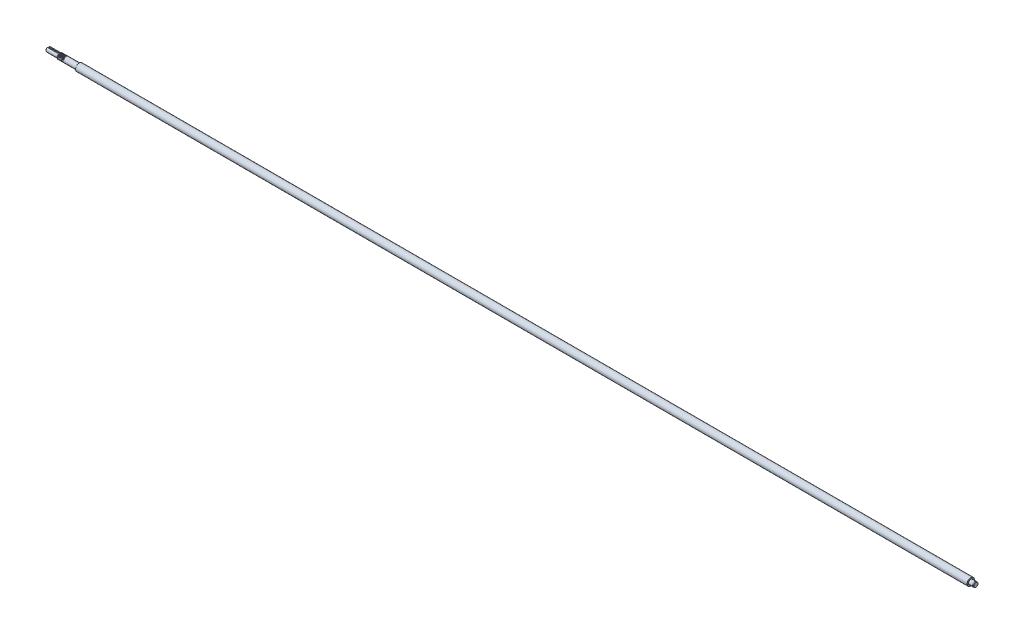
SolidWorks part; units mm, degrees
ref_plane "Front Plane" through (0, 0, 0) normal (0, 0, 1) x (1, 0, 0)
ref_plane "Top Plane" through (0, 0, 0) normal (0, 1, 0) x (1, 0, 0)
ref_plane "Right Plane" through (0, 0, 0) normal (1, 0, 0) x (0, 0, -1)
sketch "Sketch1" plane through (0, 0, 0) normal (0, 0, 1) x (1, 0, 0)
  line L0 (-23.245, 0) -> (-23.245, 5)
  line L1 (-23.245, 5) -> (1.755, 5)
  line L2 (1.755, 5) -> (1.755, 6)
  line L3 (1.755, 6) -> (43.755, 6)
  line L4 (43.755, 6) -> (43.755, 7.9)
  line L5 (43.755, 7.9) -> (1965.755, 7.9)
  line L6 (1965.755, 7.9) -> (1965.755, 5)
  line L7 (1965.755, 5) -> (1973.755, 5)
  line L8 (1973.755, 5) -> (1973.755, 4.8)
  line L9 (1973.755, 4.8) -> (1974.905, 4.8)
  line L10 (1974.905, 4.8) -> (1974.905, 5)
  line L11 (1974.905, 5) -> (1976.755, 5)
  line L12 (1976.755, 5) -> (1976.755, 0)
  line L13 (1976.755, 0) -> (-23.245, 0)
  point P3 (43.755, 6.95)
  dimension "D1" = 5
  dimension "D2" = 25
  dimension "D3" = 6
  dimension "D4" = 67
  dimension "D5" = 1922
  dimension "D6" = 11
  dimension "D7" = 5
  dimension "D8" = 4.8
  dimension "D9" = 1.15
  dimension "D10" = 1.85
  dimension "D11" = 7.9
revolve "Revolve1" add sketch "Sketch1" angle 360 about L13
chamfer "Chamfer1" distance 0.5 angle 45 2 edges at (-23.245, 5, 0) (1976.755, 5, 0)
chamfer "Chamfer2" distance 0.2 angle 45 3 edges at (1965.755, 7.9, 0) (43.755, 7.9, 0) (1.755, 6, 0)
ref_plane "Plane1" through (0, 5, 0) normal (0, 1, 0) x (1, 0, 0)
sketch "Sketch2" plane through (0, 5, 0) normal (0, 1, 0) x (1, 0, 0)
  line L0 (-23.245, 0) -> (-2.245, 0) construction
  line L1 (-23.245, 4.5) -> (-23.245, -4.5) construction
  line L2 (-23.245, 2) -> (-2.245, 2)
  line L3 (-23.245, -2) -> (-2.245, -2)
  arc A0 (-23.245, 2) -> (-23.245, -2) centre (-23.245, 0) ccw
  arc A1 (-2.245, -2) -> (-2.245, 2) centre (-2.245, 0) ccw
  point P5 (-12.745, 0)
  dimension "D1" = 21
  dimension "D2" = 4
extrude "Cut-Extrude1" cut sketch "Sketch2" against normal blind 2.5
thread "Thread1" pitch 0.8 start angle 0, offset 0, length 14, pitch 1, diameter 12
ref_plane "Plane2" through (1.955, 0, -6) normal (0, -1, 0) x (0, 0, -1)
sketch "Thread Profile1" plane through (1.955, 0, -6) normal (0, -1, 0) x (0, 0, -1)
  line L0 (0, 0) -> (0, 0.8) construction
  line L11 (0, 0) -> (0, 0.7)
  line L12 (0, 0.7) -> (-0.433, 0.45)
  line L13 (-0.433, 0.45) -> (-0.433, 0.25)
  line L15 (-0.433, 0.25) -> (0, 0)
  line L17 (-0.433, 0.35) -> (0, 0.35) construction
  point P2 (0, 0)
  dimension "Pitch" = 0.8
  dimension "Profile_Angle" = 60
  dimension "Profile_Land" = 0.2
  dimension "Profile_Height" = 0.433
